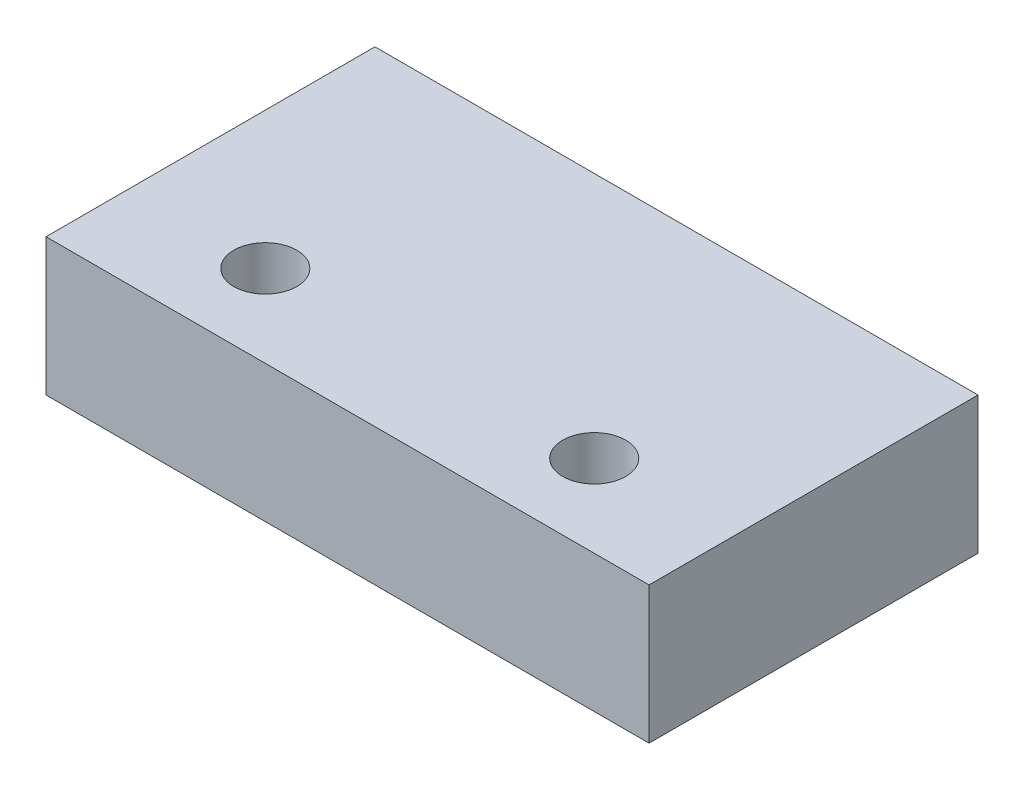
SolidWorks part; units mm, degrees
ref_plane "Ebene vorne" through (0, 0, 0) normal (0, 0, 1) x (1, 0, 0)
ref_plane "Ebene oben" through (0, 0, 0) normal (0, 1, 0) x (1, 0, 0)
ref_plane "Ebene rechts" through (0, 0, 0) normal (1, 0, 0) x (0, 0, -1)
sketch "Skizze1" plane through (0, 0, 0) normal (0, 1, 0) x (1, 0, 0)
  line L0 (0, 67.9766) -> (0, -42.9326) construction
  line L2 (-11, 0) -> (11, 0)
  line L3 (-11, 0) -> (-11, -12)
  line L4 (-11, -12) -> (11, -12)
  line L5 (11, 0) -> (11, -12)
  circle A0 centre (-6, -9) radius 1.15
  circle A1 centre (6, -9) radius 1.15
  dimension "D3" = 2.3
  dimension "D1" = 22
  dimension "D2" = 12
  dimension "D4" = 3
  dimension "D5" = 5
extrude "Aufsatz-Linear austragen1" add sketch "Skizze1" along normal blind 5
sketch "Skizze2" plane through (11, 0, 0) normal (1, 0, 0) x (0, 0, -1)
  line L0 (-3, 5) -> (-3, 0) construction
  line L1 (-12, 5) -> (0, 5) construction
  line L2 (-12, 0) -> (0, 0) construction
  line L3 (0, 5) -> (0, 0) construction
  circle A0 centre (-3, 2.5) radius 1.5
  dimension "D2" = 3
  dimension "D1" = 3
